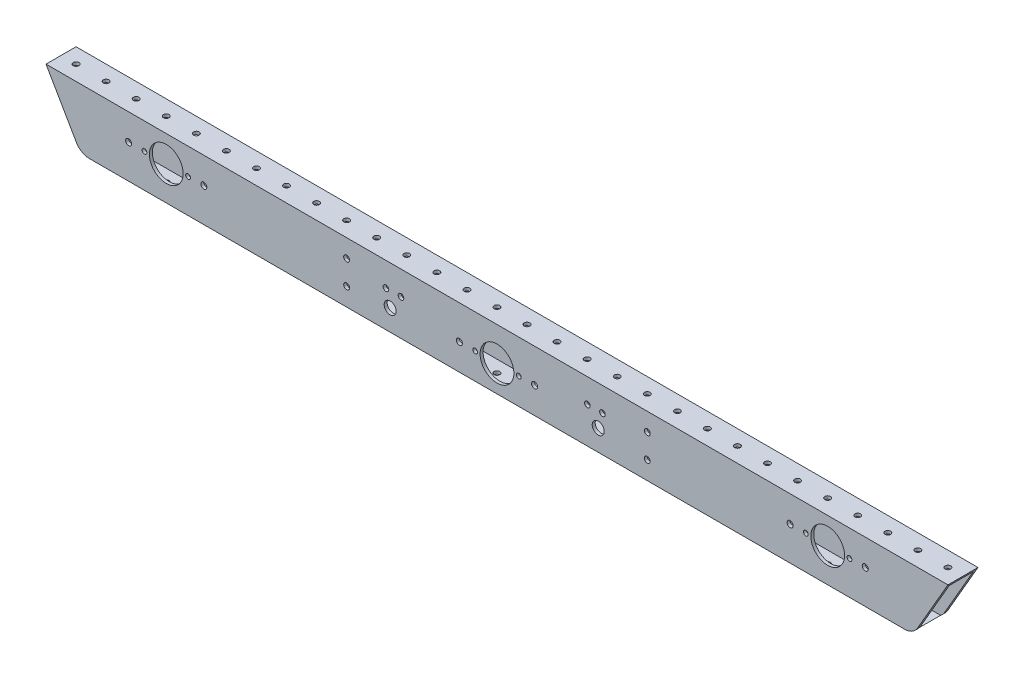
SolidWorks part; units mm, degrees
ref_plane "Front Plane" through (0, 0, 0) normal (0, 0, 1) x (1, 0, 0)
ref_plane "Top Plane" through (0, 0, 0) normal (0, 1, 0) x (1, 0, 0)
ref_plane "Right Plane" through (0, 0, 0) normal (1, 0, 0) x (0, 0, -1)
sketch "Sketch1" plane through (0, 0, 0) normal (0, 0, 1) x (1, 0, 0)
  line L0 (-378.46, -22.86) -> (-378.46, 22.86) construction
  line L1 (-381, -25.4) -> (381, -25.4)
  line L2 (-381, -25.4) -> (-381, 25.4)
  line L3 (-381, 25.4) -> (381, 25.4)
  line L4 (381, -25.4) -> (381, 25.4)
  line L5 (-381, -25.4) -> (381, 25.4) construction
  line L6 (-381, 25.4) -> (381, -25.4) construction
  line L7 (-378.46, 22.86) -> (378.46, 22.86) construction
  line L8 (378.46, -22.86) -> (378.46, 22.86) construction
  line L9 (-378.46, -22.86) -> (378.46, -22.86) construction
  line L10 (0, 25.4) -> (0, -25.4) construction
  line L11 (0, 3.175) -> (279.4, 3.175) construction
  line L12 (-279.4, 3.175) -> (0, 3.175) construction
  circle A0 centre (0, -3.175) radius 19.685 construction
  circle A1 centre (-279.4, 3.175) radius 19.685 construction
  circle A2 centre (279.4, 3.175) radius 19.685 construction
  circle A3 centre (-279.4, 3.175) radius 76.2 construction
  circle A4 centre (0, -3.175) radius 76.2 construction
  circle A5 centre (279.4, 3.175) radius 76.2 construction
  circle A6 centre (-279.4, 3.175) radius 14.2748
  circle A7 centre (0, -3.175) radius 14.2748
  circle A8 centre (279.4, 3.175) radius 14.2748
  point P0 (0, 0)
  dimension "D4" = 39.37
  dimension "D5" = 152.4
  dimension "D7" = 28.5496
  dimension "D1" = 762
  dimension "D2" = 50.8
  dimension "D6" = 279.4
  dimension "D8" = 6.35
  dimension "D3" = 2.54
extrude "Boss-Extrude1" add sketch "Sketch1" along normal blind 25.4
sketch "Sketch2" plane through (381, 0, 0) normal (1, 0, 0) x (0, 0, -1)
  line L17 (-22.86, -22.86) -> (-2.54, -22.86)
  line L18 (-2.54, -22.86) -> (-2.54, 22.86)
  line L19 (-2.54, 22.86) -> (-22.86, 22.86)
  line L20 (-22.86, 22.86) -> (-22.86, -22.86)
  line L21 (-22.86, -22.86) -> (-2.54, -22.86)
  line L22 (-2.54, -22.86) -> (-2.54, 22.86)
  line L23 (-2.54, 22.86) -> (-22.86, 22.86)
  line L24 (-22.86, 22.86) -> (-22.86, -22.86)
  dimension "D1" = 2.54
extrude "Cut-Extrude1" cut sketch "Sketch2" against normal through all
sketch "Sketch3" plane through (0, 25.4, 0) normal (0, 1, 0) x (1, 0, 0)
  line L0 (-381, -12.7) -> (381, -12.7) construction
  line L1 (-381, -25.4) -> (-381, 0) construction
  line L2 (381, -25.4) -> (381, 0) construction
  circle A0 centre (-368.3, -12.7) radius 2.3813
  circle A1 centre (-342.9, -12.7) radius 2.3813
  circle A2 centre (-317.5, -12.7) radius 2.3813
  circle A3 centre (-292.1, -12.7) radius 2.3813
  circle A4 centre (-266.7, -12.7) radius 2.3813
  circle A5 centre (-241.3, -12.7) radius 2.3813
  circle A6 centre (-215.9, -12.7) radius 2.3813
  circle A7 centre (-190.5, -12.7) radius 2.3813
  circle A8 centre (-165.1, -12.7) radius 2.3813
  circle A9 centre (-139.7, -12.7) radius 2.3813
  circle A10 centre (-114.3, -12.7) radius 2.3813
  circle A11 centre (-88.9, -12.7) radius 2.3813
  circle A12 centre (-63.5, -12.7) radius 2.3813
  circle A13 centre (-38.1, -12.7) radius 2.3813
  circle A14 centre (-12.7, -12.7) radius 2.3813
  circle A15 centre (12.7, -12.7) radius 2.3813
  circle A16 centre (38.1, -12.7) radius 2.3813
  circle A17 centre (63.5, -12.7) radius 2.3813
  circle A18 centre (88.9, -12.7) radius 2.3813
  circle A19 centre (114.3, -12.7) radius 2.3813
  circle A20 centre (139.7, -12.7) radius 2.3813
  circle A21 centre (165.1, -12.7) radius 2.3813
  circle A22 centre (190.5, -12.7) radius 2.3813
  circle A23 centre (215.9, -12.7) radius 2.3813
  circle A24 centre (241.3, -12.7) radius 2.3813
  circle A25 centre (266.7, -12.7) radius 2.3813
  circle A26 centre (292.1, -12.7) radius 2.3813
  circle A27 centre (317.5, -12.7) radius 2.3813
  circle A28 centre (342.9, -12.7) radius 2.3813
  circle A29 centre (368.3, -12.7) radius 2.3813
  dimension "D1" = 4.7625
  dimension "D2" = 12.7
  dimension "D3" = 30
extrude "Cut-Extrude2" cut sketch "Sketch3" against normal through all
sketch "Sketch4" plane through (0, 0, 25.4) normal (0, 0, 1) x (1, 0, 0)
  line L0 (-381, 25.4) -> (-355.3368, -19.05)
  line L1 (-381, -25.4) -> (381, -25.4) construction
  line L2 (381, 25.4) -> (355.3368, -19.05)
  line L3 (-381, -96.5954) -> (381, -96.5954)
  line L4 (-381, -96.5954) -> (-381, 25.4)
  line L5 (344.3383, -25.4) -> (-344.3383, -25.4)
  line L6 (381, -96.5954) -> (381, 25.4)
  arc A0 (355.3368, -19.05) -> (344.3383, -25.4) centre (344.3383, -12.7) cw
  arc A1 (-355.3368, -19.05) -> (-344.3383, -25.4) centre (-344.3383, -12.7) ccw
  point P13 (351.6706, -25.4)
  point P16 (-351.6706, -25.4)
  dimension "D2" = 12.7
  dimension "D1" = 30
extrude "Cut-Extrude3" cut sketch "Sketch4" against normal through all
sketch "Sketch6" plane through (0, 0, 25.4) normal (0, 0, 1) x (1, 0, 0)
  line L0 (165.1, 111.319) -> (165.1, -89.3201) construction
  line L1 (165.1, 0) -> (97.6072, 0) construction
  line L3 (127, 10.16) -> (152.4, 10.16) construction
  line L4 (127, 10.16) -> (127, -10.16) construction
  line L5 (127, -10.16) -> (152.4, -10.16) construction
  line L6 (152.4, 10.16) -> (152.4, -10.16) construction
  circle A0 centre (152.4, 10.16) radius 2.4892 construction
  circle A1 centre (152.4, -10.16) radius 2.4892 construction
  circle A2 centre (127, 10.16) radius 2.4892
  circle A3 centre (127, -10.16) radius 2.4892
  point P14 (152.4, 0)
  dimension "D2" = 4.9784
  dimension "D1" = 215.9
  dimension "D3" = 12.7
  dimension "D4" = 20.32
  dimension "D6" = 25.4
extrude "Cut-Extrude4" cut sketch "Sketch6" against normal through all
mirror "Mirror1" about plane through (0, 0, 0) normal (1, 0, 0) of "Cut-Extrude4"
sketch "Sketch7" plane through (0, 0, 25.4) normal (0, 0, 1) x (1, 0, 0)
  line L1 (85.536, -7.6177) -> (-90.232, -7.6177) construction
  line L2 (85.536, -7.6177) -> (85.536, 5.0823) construction
  line L3 (85.536, 5.0823) -> (-90.232, 5.0823) construction
  line L4 (381, 25.4) -> (-381, 25.4)
  line L5 (-381, 25.4) -> (-355.3368, -19.05)
  line L6 (-344.3383, -25.4) -> (344.3383, -25.4)
  line L7 (355.3368, -19.05) -> (381, 25.4)
  line L8 (381, 25.4) -> (-381, 25.4)
  line L9 (-381, 25.4) -> (-355.3368, -19.05)
  line L10 (-344.3383, -25.4) -> (344.3383, -25.4)
  line L11 (355.3368, -19.05) -> (381, 25.4)
  line L12 (-90.232, -7.6177) -> (-90.232, 5.0823) construction
  circle A0 centre (-90.232, -7.6177) radius 5.08
  circle A1 centre (76.392, 5.0823) radius 2.3813
  arc A2 (-355.3368, -19.05) -> (-344.3383, -25.4) centre (-344.3383, -12.7) ccw
  arc A3 (344.3383, -25.4) -> (355.3368, -19.05) centre (344.3383, -12.7) ccw
  arc A4 (-355.3368, -19.05) -> (-344.3383, -25.4) centre (-344.3383, -12.7) ccw
  arc A5 (344.3383, -25.4) -> (355.3368, -19.05) centre (344.3383, -12.7) ccw
  circle A6 centre (76.392, 5.0823) radius 2.3813
  circle A7 centre (89.092, 5.0823) radius 2.3813
  circle A8 centre (89.092, 5.0823) radius 2.3813
  circle A9 centre (-81.088, 5.0823) radius 2.3813
  circle A10 centre (-81.088, 5.0823) radius 2.3813
  circle A11 centre (-93.788, 5.0823) radius 2.3813
  circle A12 centre (-93.788, 5.0823) radius 2.3813
  circle A13 centre (85.536, -7.6177) radius 5.08
  circle A44 centre (85.536, -7.6177) radius 2.4892 construction
  circle A45 centre (85.536, -7.6177) radius 2.4892
  dimension "D8" = 10.16
  dimension "D6" = 9.144
  dimension "D7" = 9.144
  dimension "D1" = 0
  dimension "D2" = 0
  dimension "D3" = 0
  dimension "D4" = 0
  dimension "D5" = 0
extrude "Cut-Extrude5" cut sketch "Sketch7" against normal through all contours A0 | A10 | A12 | A6 | A8 | A13 A45 | A45
sketch "Sketch9" plane through (0, 0, 25.4) normal (0, 0, 1) x (1, 0, 0)
  line L0 (-311.15, 3.175) -> (-247.65, 3.175) construction
  line L1 (-31.75, -3.175) -> (31.75, -3.175) construction
  line L2 (311.15, 3.175) -> (247.65, 3.175) construction
  line L3 (-260.9723, 3.175) -> (-297.8277, 3.175) construction
  line L4 (18.4277, -3.175) -> (-18.4277, -3.175) construction
  line L5 (260.9723, 3.175) -> (297.8277, 3.175) construction
  circle A0 centre (-311.15, 3.175) radius 2.5527
  circle A1 centre (-247.65, 3.175) radius 2.5527
  circle A2 centre (-31.75, -3.175) radius 2.5527
  circle A3 centre (31.75, -3.175) radius 2.5527
  circle A4 centre (247.65, 3.175) radius 2.5527
  circle A5 centre (311.15, 3.175) radius 2.5527
  circle A6 centre (-297.8277, 3.175) radius 2.0193
  circle A7 centre (-260.9723, 3.175) radius 2.0193
  circle A8 centre (-18.4277, -3.175) radius 2.0193
  circle A9 centre (18.4277, -3.175) radius 2.0193
  circle A10 centre (260.9723, 3.175) radius 2.0193
  circle A11 centre (297.8277, 3.175) radius 2.0193
  point P9 (0, -3.175)
  point P11 (-279.4, 3.175)
  point P12 (-279.4, 3.175)
  point P13 (279.4, 3.175)
  point P14 (279.4, 3.175)
  point P24 (-279.4, 3.175)
  point P27 (0, -3.175)
  point P30 (279.4, 3.175)
  dimension "D2" = 5.1054
  dimension "D6" = 4.0386
  dimension "D1" = 31.75
  dimension "D3" = 18.4277
  dimension "D4" = 18.4277
  dimension "D5" = 18.4277
extrude "Cut-Extrude6" cut sketch "Sketch9" against normal through all
sketch "Sketch10" plane through (0, 0, 25.4) normal (0, 0, 1) x (1, 0, 0)
  line L0 (-334.2616, 12.7) -> (-319.5969, -12.7)
  line L1 (-235.537, 12.7) -> (-220.8723, -12.7)
  line L2 (-157.7372, 12.7) -> (-143.0725, -12.7)
  line L3 (-59.2756, 12.7) -> (-73.9403, -12.7)
  line L4 (-54.8616, -12.7) -> (-40.1969, 12.7)
  line L5 (40.1969, 12.7) -> (54.8616, -12.7)
  line L6 (54.5796, 12.7) -> (69.2443, -12.7)
  line L7 (141.9753, 12.7) -> (156.64, -12.7)
  line L8 (224.5384, 12.7) -> (239.2031, -12.7)
  line L9 (319.5969, -12.7) -> (334.2616, 12.7)
  line L10 (231.1496, 15.1732) -> (149.0178, -15.5514) construction
  line L11 (232.8183, 10.7126) -> (150.6865, -20.012)
  line L12 (229.481, 19.6338) -> (147.3492, -11.0908)
  line L13 (-143.0725, -12.7) -> (-235.537, 12.7) construction
  line L14 (-144.334, -17.2924) -> (-236.7985, 8.1076)
  line L15 (-141.811, -8.1076) -> (-234.2754, 17.2924)
  line L22 (344.3383, -12.7) -> (359.003, 12.7)
  line L23 (-344.3383, -12.7) -> (344.3383, -12.7)
  line L24 (-359.003, 12.7) -> (-344.3383, -12.7)
  line L25 (359.003, 12.7) -> (-359.003, 12.7)
  line L26 (344.3383, -12.7) -> (359.003, 12.7)
  line L27 (-344.3383, -12.7) -> (344.3383, -12.7)
  line L28 (-359.003, 12.7) -> (-344.3383, -12.7)
  line L29 (359.003, 12.7) -> (-359.003, 12.7)
  arc A0 (232.8183, 10.7126) -> (229.481, 19.6338) centre (231.1496, 15.1732) ccw
  arc A1 (147.3492, -11.0908) -> (150.6865, -20.012) centre (149.0178, -15.5514) ccw
  arc A2 (-144.334, -17.2924) -> (-141.811, -8.1076) centre (-143.0725, -12.7) ccw
  arc A3 (-234.2754, 17.2924) -> (-236.7985, 8.1076) centre (-235.537, 12.7) ccw
  circle A8 centre (-311.15, 3.175) radius 15.2527
  circle A9 centre (-311.15, 3.175) radius 15.2527 construction
  circle A11 centre (-247.65, 3.175) radius 15.2527
  circle A12 centre (-247.65, 3.175) radius 15.2527 construction
  circle A14 centre (-127, 10.16) radius 15.1892
  circle A15 centre (-127, 10.16) radius 15.1892 construction
  circle A17 centre (-127, -10.16) radius 15.1892
  circle A18 centre (-127, -10.16) radius 15.1892 construction
  circle A20 centre (-81.088, 5.0823) radius 15.0813
  circle A21 centre (-81.088, 5.0823) radius 15.0813 construction
  circle A23 centre (-90.232, -7.6177) radius 17.78
  circle A24 centre (-90.232, -7.6177) radius 17.78 construction
  circle A26 centre (-31.75, -3.175) radius 15.2527
  circle A27 centre (-31.75, -3.175) radius 15.2527 construction
  circle A29 centre (0, -3.175) radius 26.9748
  circle A30 centre (0, -3.175) radius 26.9748 construction
  circle A32 centre (31.75, -3.175) radius 15.2527
  circle A33 centre (31.75, -3.175) radius 15.2527 construction
  circle A35 centre (76.392, 5.0823) radius 15.0813
  circle A36 centre (76.392, 5.0823) radius 15.0813 construction
  circle A38 centre (85.536, -7.6177) radius 17.78
  circle A39 centre (85.536, -7.6177) radius 17.78 construction
  circle A44 centre (127, 10.16) radius 15.1892
  circle A45 centre (127, 10.16) radius 15.1892 construction
  circle A47 centre (127, -10.16) radius 15.1892
  circle A48 centre (127, -10.16) radius 15.1892 construction
  circle A50 centre (247.65, 3.175) radius 15.2527
  circle A51 centre (247.65, 3.175) radius 15.2527 construction
  circle A53 centre (311.15, 3.175) radius 15.2527
  circle A54 centre (311.15, 3.175) radius 15.2527 construction
  point P71 (190.0837, -0.1891)
  point P74 (-189.3047, 0)
  dimension "D2" = 4.7625
  dimension "D14" = 4.7625
  dimension "D1" = 12.7
  dimension "D3" = 12.7
  dimension "D4" = 12.7
  dimension "D5" = 12.7
  dimension "D6" = 12.7
  dimension "D7" = 12.7
  dimension "D8" = 12.7
  dimension "D9" = 12.7
  dimension "D10" = 12.7
  dimension "D11" = 12.7
  dimension "D12" = 12.7
  dimension "D13" = 12.7
  dimension "D15" = 12.7
  dimension "D16" = 12.7
  dimension "D17" = 12.7
  dimension "D18" = 12.7
extrude "Cut-Extrude7" [suppressed] cut sketch "Sketch10" against normal through all
fillet "Fillet1" [suppressed] radius 3.175
